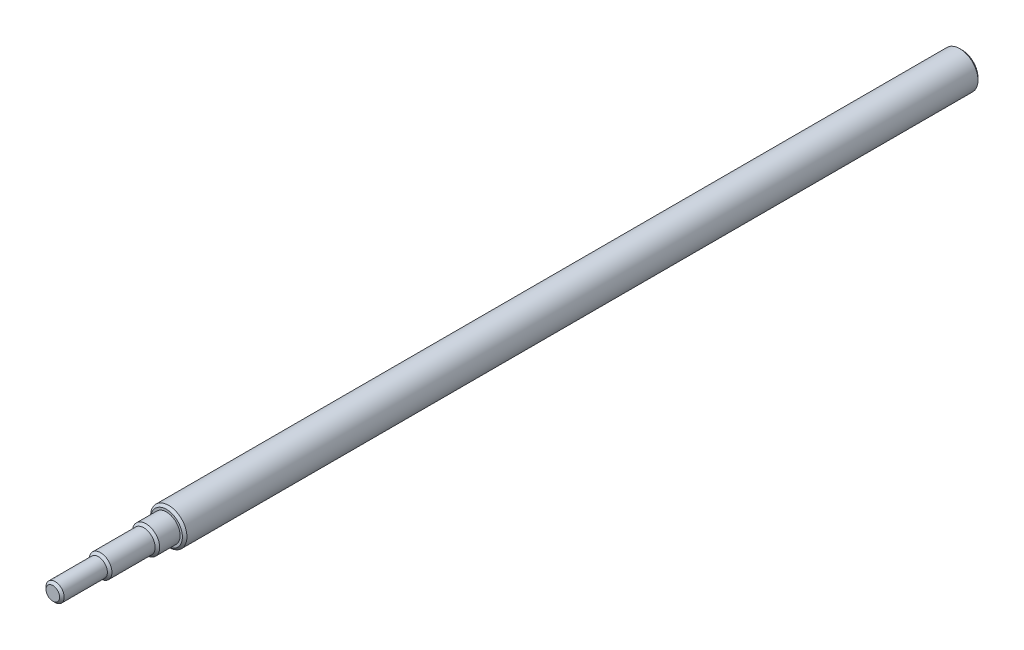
SolidWorks part; units mm, degrees
ref_plane "前视基准面" through (0, 0, 0) normal (0, 0, 1) x (1, 0, 0)
ref_plane "上视基准面" through (0, 0, 0) normal (0, 1, 0) x (1, 0, 0)
ref_plane "右视基准面" through (0, 0, 0) normal (1, 0, 0) x (0, 0, -1)
sketch "草图1" plane through (0, 0, 0) normal (0, 0, 1) x (1, 0, 0)
  circle A0 centre (0, 0) radius 8
extrude "凸台-拉伸1" add sketch "草图1" along normal blind 350
sketch "草图2" plane through (0, 0, 350) normal (0, 0, 1) x (1, 0, 0)
  circle A0 centre (0, 0) radius 6
extrude "凸台-拉伸2" add sketch "草图2" along normal blind 10
sketch "草图3" plane through (0, 0, 360) normal (0, 0, 1) x (1, 0, 0)
  circle A0 centre (0, 0) radius 5
extrude "凸台-拉伸3" add sketch "草图3" along normal blind 20
sketch "草图4" plane through (0, 0, 380) normal (0, 0, 1) x (1, 0, 0)
  circle A0 centre (0, 0) radius 4
extrude "凸台-拉伸4" add sketch "草图4" along normal blind 20
chamfer "倒角1" distance 1 angle 45 1 edges at (8, 0, 0)
chamfer "倒角2" distance 1 angle 45 1 edges at (8, 0, 350)
chamfer "倒角3" distance 1 angle 45 3 edges at (4, 0, 400) (5, 0, 380) (6, 0, 360)
